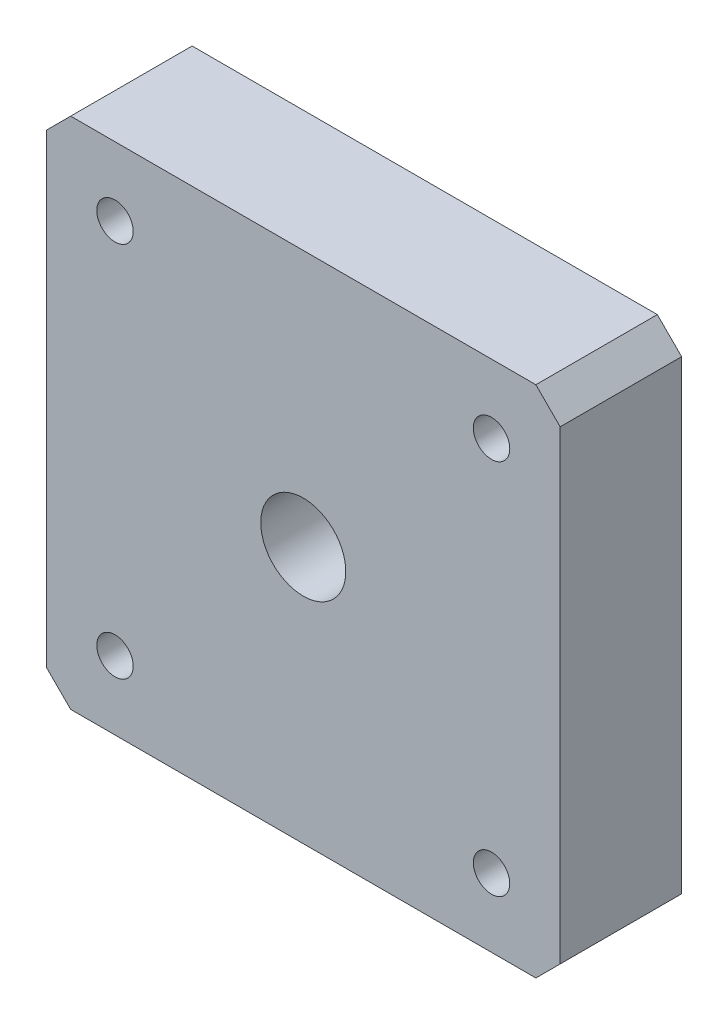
SolidWorks part; units mm, degrees
ref_plane "前视" through (0, 0, 0) normal (0, 0, 1) x (1, 0, 0)
ref_plane "上视" through (0, 0, 0) normal (0, 1, 0) x (1, 0, 0)
ref_plane "右视" through (0, 0, 0) normal (1, 0, 0) x (0, 0, -1)
sketch "草图1" plane through (0, 0, 0) normal (0, 0, 1) x (1, 0, 0)
  line L0 (-19.15, 21.15) -> (-21.15, 19.15)
  line L1 (19.15, -21.15) -> (-19.15, -21.15)
  line L2 (21.15, -19.15) -> (21.15, 19.15)
  line L3 (19.15, 21.15) -> (-19.15, 21.15)
  line L4 (-21.15, -19.15) -> (-21.15, 19.15)
  line L5 (21.15, -21.15) -> (-21.15, 21.15) construction
  line L6 (21.15, 21.15) -> (-21.15, -21.15) construction
  line L23 (19.15, 21.15) -> (21.15, 19.15)
  line L24 (-21.15, -19.15) -> (-19.15, -21.15)
  line L25 (21.15, -19.15) -> (19.15, -21.15)
  point P0 (0, 0)
  dimension "D1" = 42.3
  dimension "D2" = 42.3
extrude "凸台-拉伸1" add sketch "草图1" along normal blind 10
sketch "草图2" plane through (0, 0, 0) normal (0, 0, -1) x (-1, 0, 0)
  circle A0 centre (0, 0) radius 11
  circle A1 centre (0, 0) radius 11.5
extrude "切除-拉伸1" cut sketch "草图2" against normal blind 0.5
sketch "草图3" plane through (0, 0, 0) normal (0, 0, -1) x (-1, 0, 0)
  circle A0 centre (0, 0) radius 11
extrude "凸台-拉伸2" add sketch "草图3" along normal blind 2
sketch "草图4" plane through (0, 0, -2) normal (0, 0, -1) x (-1, 0, 0)
  circle A0 centre (0, 0) radius 3.5
extrude "切除-拉伸2" cut sketch "草图4" against normal blind 12
sketch "草图5" plane through (0, 0, 0) normal (0, 0, -1) x (-1, 0, 0)
  line L5 (15.5, -15.5) -> (-15.5, 15.5) construction
  line L6 (15.5, 15.5) -> (-15.5, -15.5) construction
  circle A0 centre (-15.5, 15.5) radius 1.5
  point P0 (0, 0)
  dimension "D1" = 31
  dimension "D2" = 31
extrude "切除-拉伸3" cut sketch "草图5" against normal blind 12
pattern_circular "阵列(圆周)1" count 4 over 360 about axis through (0, 0, 0) along (0, 0, 1) of "切除-拉伸3"
